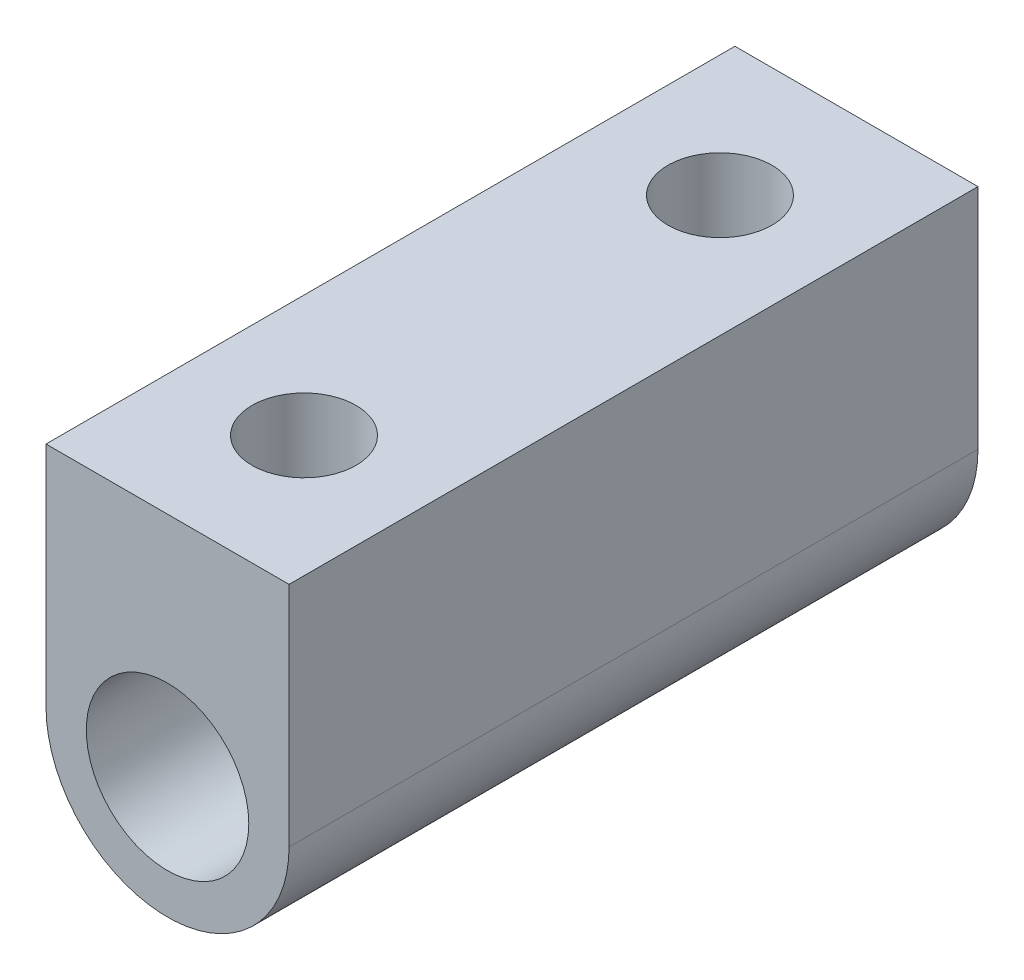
SolidWorks part; units mm, degrees
ref_plane "Plan de face" through (0, 0, 0) normal (0, 0, 1) x (1, 0, 0)
ref_plane "Plan de dessus" through (0, 0, 0) normal (0, 1, 0) x (1, 0, 0)
ref_plane "Plan de droite" through (0, 0, 0) normal (1, 0, 0) x (0, 0, -1)
sketch "Esquisse1" plane through (0, 0, 0) normal (0, 0, 1) x (1, 0, 0)
  line L0 (-1.87, 3.5) -> (-1.87, -0.744)
  line L1 (-1.87, 3.5) -> (-1.87, 0)
  line L2 (1.87, 3.5) -> (-1.87, 3.5)
  line L3 (1.87, 3.5) -> (-1.87, 3.5)
  line L4 (1.87, -0.744) -> (1.87, 3.5)
  line L5 (1.87, 0) -> (1.87, 3.5)
  arc A0 (-1.87, 0) -> (1.87, 0) centre (0, 0) ccw
extrude "Boss.-Extru.1" add sketch "Esquisse1" along normal offset from surface 2.5 and the other way offset from surface (5.3 mm away) 2.5
sketch "Esquisse2" plane through (0, 0, 0) normal (0, 0, 1) x (1, 0, 0)
  circle A0 centre (0, 0) radius 1.25
  dimension "D1" = 2.5
extrude "Enlèv. mat.-Extru.1" cut sketch "Esquisse2" against normal through all both and the other way through all
hole_wizard "Trou taraudé M21" positions "Esquisse4" profile "Esquisse3" tap size "M2" standard "ISO"
sketch "Esquisse4" plane through (0, 3.5, 0) normal (0, 1, 0) x (1, 0, 0)
  point P0 (0, -3.2)
  point P3 (0, 3.2)
sketch "Esquisse3" plane through (0, 3.5, 3.2) normal (1, 0, 0) x (0, 0, 1)
  line L0 (0, 0) -> (0, 2.25)
  line L1 (0, 2.25) -> (0.8, 2.25)
  line L2 (0.8, 2.25) -> (0.8, 0)
  line L5 (0.8, 0) -> (0, 0)
  line L11 (0, -6.35) -> (0, 107.95) construction
  dimension "Diamètre du trou pour taraudage jusqu'au prochain" = 1.6
  dimension "Profondeur du trou pour taraudage jusqu'au prochain" = 2.25
